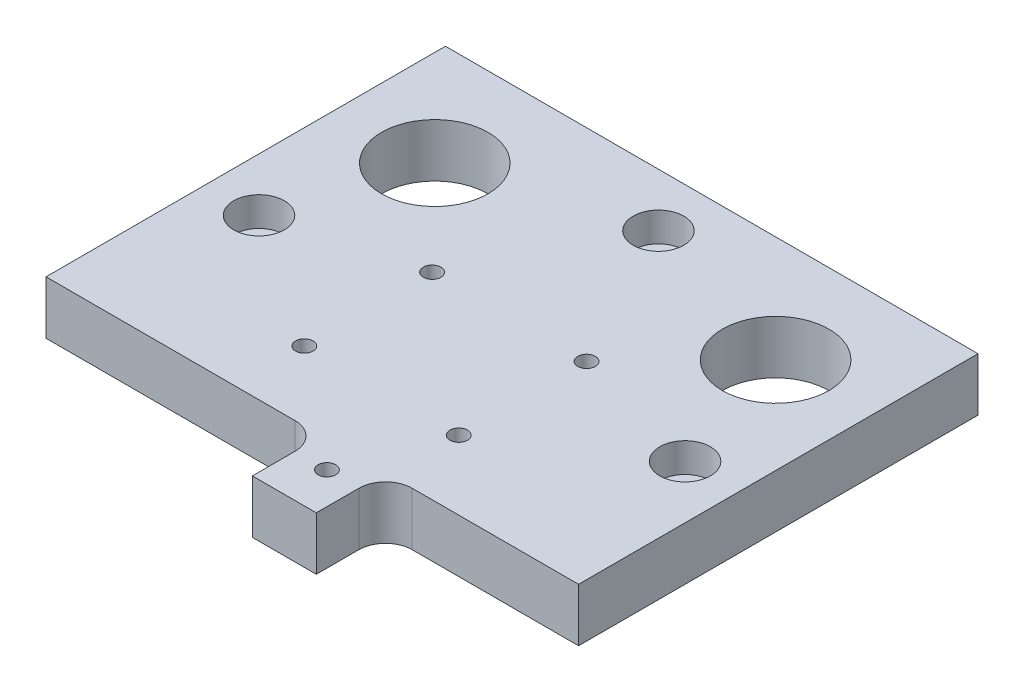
SolidWorks part; units mm, degrees
ref_plane "前视基准面" through (0, 0, 0) normal (0, 0, 1) x (1, 0, 0)
ref_plane "上视基准面" through (0, 0, 0) normal (0, 1, 0) x (1, 0, 0)
ref_plane "右视基准面" through (0, 0, 0) normal (1, 0, 0) x (0, 0, -1)
sketch "草图1" plane through (0, 0, 0) normal (0, 0, 1) x (1, 0, 0)
  line L0 (0, 0) -> (100, 0)
  line L1 (0, 10) -> (100, 10)
  line L2 (100, 0) -> (100, 10)
  line L3 (0, 0) -> (0, 10)
extrude "凸台-拉伸1" add sketch "草图1" along normal blind 88
sketch "草图2" plane through (0, 10, 0) normal (0, 1, 0) x (1, 0, 0)
  line L0 (0, 0) -> (100, 0)
  line L1 (51.75, -88) -> (63.75, -88)
  line L2 (100, -75) -> (100, 0)
  line L3 (0, -75) -> (0, 0)
  line L4 (0, -75) -> (46.75, -75)
  line L5 (51.75, -88) -> (51.75, -80)
  line L6 (63.75, -88) -> (63.75, -80)
  line L7 (68.75, -75) -> (100, -75)
  circle A0 centre (18, -20) radius 10
  circle A1 centre (82, -20) radius 10
  arc A2 (68.75, -75) -> (63.75, -80) centre (68.75, -80) ccw
  arc A3 (51.75, -80) -> (46.75, -75) centre (46.75, -80) ccw
  circle A4 centre (57.75, -80) radius 1.65
  circle A5 centre (50, -10) radius 2.75
  circle A6 centre (10, -45) radius 2.75
  circle A7 centre (90, -45) radius 2.75
  circle A8 centre (64.5, -62) radius 1.65
  circle A9 centre (64.5, -38) radius 1.65
  circle A10 centre (35.5, -38) radius 1.65
  circle A11 centre (35.5, -62) radius 1.65
extrude "切除-拉伸1" cut sketch "草图2" against normal blind 88 flip side to cut
sketch "草图3" plane through (0, 10, 0) normal (0, 1, 0) x (1, 0, 0)
  circle A0 centre (50, -10) radius 4.75
  circle A1 centre (10, -45) radius 4.75
  circle A2 centre (90, -45) radius 4.75
extrude "切除-拉伸2" cut sketch "草图3" against normal blind 5.5
sketch "草图4" plane through (0, 10, 0) normal (0, 1, 0) x (1, 0, 0)
  circle A0 centre (39.4975, -45) radius 3.25 construction
  circle A1 centre (56.9975, -45) radius 3.25 construction
  circle A2 centre (50, -10) radius 4.75
  circle A3 centre (10, -45) radius 4.75
  circle A4 centre (90, -45) radius 4.75
sketch "草图5" plane through (0, 0, 0) normal (0, -1, 0) x (1, 0, 0)
  circle A0 centre (39.4975, 45) radius 3.25
  circle A1 centre (56.9975, 45) radius 3.25
extrude "切除-拉伸3" cut sketch "草图5" against normal blind 5.5
